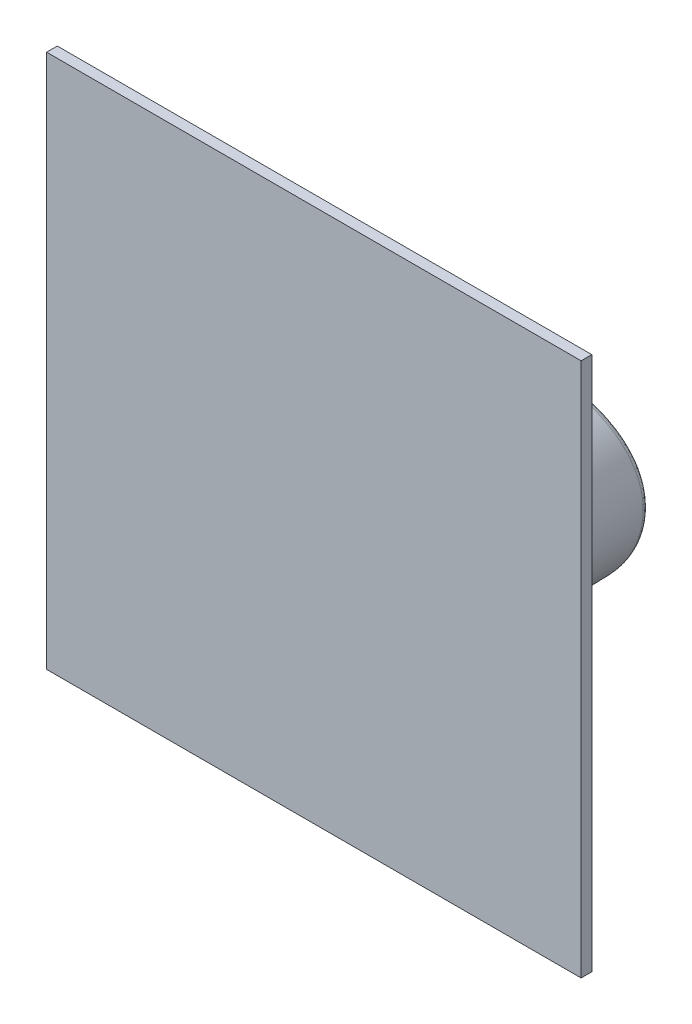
SolidWorks part; units mm, degrees
ref_plane "Plan de face" through (0, 0, 0) normal (0, 0, 1) x (1, 0, 0)
ref_plane "Plan de dessus" through (0, 0, 0) normal (0, 1, 0) x (1, 0, 0)
ref_plane "Plan de droite" through (0, 0, 0) normal (1, 0, 0) x (0, 0, -1)
sketch "Esquisse1" plane through (0, 0, 0) normal (0, 0, 1) x (1, 0, 0)
  line L1 (-35, 25) -> (35, 25)
  line L2 (-35, 25) -> (-35, -25)
  line L3 (-35, -25) -> (35, -25)
  line L4 (35, 25) -> (35, -25)
  dimension "D1" = 25
  dimension "D2" = 25
  dimension "D3" = 35
  dimension "D4" = 35
extrude "Extrusion1" add sketch "Esquisse1" against normal blind 35
other "Empreinte1"
other "boitier dépouillé<1>@Assemblage noyau jmh1"
sketch "Esquisse2" plane through (0, 0, 0) normal (0, 0, 1) x (1, 0, 0)
  line L2 (0.6257, 14.9997) -> (-0.6257, 14.9997)
  line L3 (-0.6257, -14.9997) -> (0.6257, -14.9997)
  line L4 (0.6257, 14.9997) -> (-0.6257, 14.9997)
  line L5 (-0.6257, -14.9997) -> (0.6257, -14.9997)
  arc A6 (-3.9506, 15.8397) -> (-0.6257, 14.9997) centre (-0.6257, 22) ccw
  arc A7 (-3.9506, 15.8397) -> (-3.9506, -15.8397) centre (-12.5, 0) ccw
  arc A8 (-0.6257, -14.9997) -> (-3.9506, -15.8397) centre (-0.6257, -22) ccw
  arc A9 (3.9506, -15.8397) -> (0.6257, -14.9997) centre (0.6257, -22) ccw
  arc A10 (3.9506, -15.8397) -> (3.9506, 15.8397) centre (12.5, 0) ccw
  arc A11 (0.6257, 14.9997) -> (3.9506, 15.8397) centre (0.6257, 22) ccw
  arc A12 (-3.9506, 15.8397) -> (-0.6257, 14.9997) centre (-0.6257, 22) ccw
  arc A13 (-3.9506, 15.8397) -> (-3.9506, -15.8397) centre (-12.5, 0) ccw
  arc A14 (-0.6257, -14.9997) -> (-3.9506, -15.8397) centre (-0.6257, -22) ccw
  arc A15 (3.9506, -15.8397) -> (0.6257, -14.9997) centre (0.6257, -22) ccw
  arc A16 (3.9506, -15.8397) -> (3.9506, 15.8397) centre (12.5, 0) ccw
  arc A17 (0.6257, 14.9997) -> (3.9506, 15.8397) centre (0.6257, 22) ccw
  dimension "D1" = 0
extrude "Extrusion2" add sketch "Esquisse2" along normal blind 2 draft 1
sketch "Esquisse3" plane through (0, 0, 2) normal (0, 0, 1) x (1, 0, 0)
  line L1 (50, -50) -> (-50, -50)
  line L2 (50, -50) -> (50, 50)
  line L3 (50, 50) -> (-50, 50)
  line L4 (-50, -50) -> (-50, 50)
  dimension "D1" = 50
  dimension "D2" = 50
  dimension "D3" = 50
  dimension "D4" = 100
extrude "Extrusion3" add sketch "Esquisse3" along normal blind 2
fillet "Congé1" radius 2 8 edges at (2.3318, -15.2468, 2) (0, -15.0346, 2) (-2.3318, -15.2468, 2) (-30.5346, 0, 2) (-2.3318, 15.2468, 2) (0, 15.0346, 2) (2.3318, 15.2468, 2) (30.5346, 0, 2)
